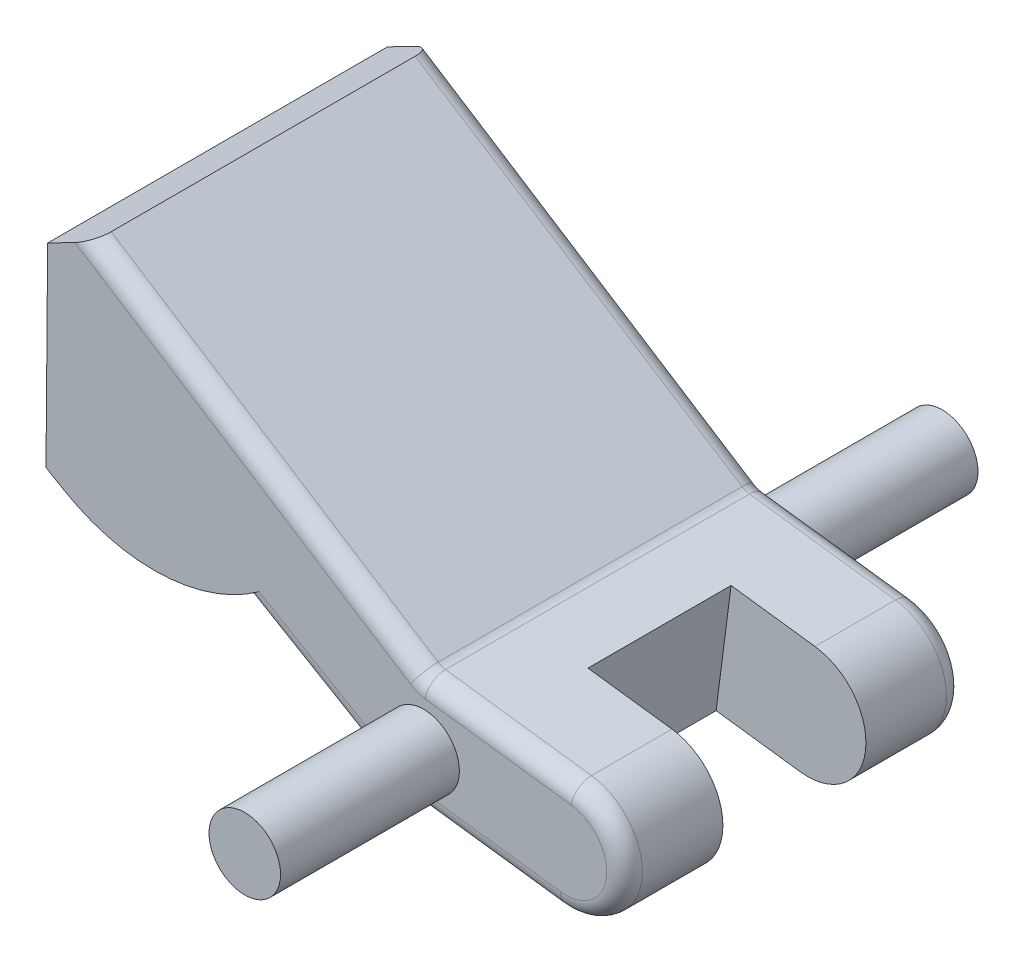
SolidWorks part; units mm, degrees
ref_plane "Front Plane" through (0, 0, 0) normal (0, 0, 1) x (1, 0, 0)
ref_plane "Top Plane" through (0, 0, 0) normal (0, 1, 0) x (1, 0, 0)
ref_plane "Right Plane" through (0, 0, 0) normal (1, 0, 0) x (0, 0, -1)
sketch "Sketch1" plane through (0, 0, 0) normal (0, 0, 1) x (1, 0, 0)
  line L0 (0, 3.5617) -> (-21, 17)
  line L2 (-1.5216, -2.5855) -> (-10.1399, 2.4865)
  line L4 (-10.1399, 2.4865) -> (-12.6759, -1.8227)
  line L5 (-12.6759, -1.8227) -> (-21.1154, 3.1441)
  line L6 (-21.1154, 3.1441) -> (-21, 17)
  line L7 (-0.3843, -2.9753) -> (7.5498, -4)
  line L8 (0, 3.5617) -> (8.3866, 2.4785)
  line L9 (-13.9572, -4) -> (8.3866, -4) construction
  arc A0 (-0.3843, -2.9753) -> (-1.5216, -2.5855) centre (0, 0) cw
  arc A1 (8.3866, 2.4785) -> (7.5498, -4) centre (7.9682, -0.7607) cw
  point P14 (0, 0)
  point P15 (0, 0)
  point P16 (8.544, 0)
  point P17 (7.5207, 2.7287)
  point P18 (7.5207, 2.7287)
  point P19 (-25.0337, 23.5654)
  point P20 (7.5514, -3.9971)
  point P21 (7.1547, -4.6702)
  point P22 (0, 0)
  point P23 (6.9769, -5)
  point P24 (22.5866, -5)
  dimension "D1" = 3
  dimension "D2" = 10
  dimension "D3" = 5
  dimension "D4" = 21
  dimension "D5" = 120
  dimension "D6" = 12
  dimension "D7" = 8
  dimension "D8" = 4
  dimension "D9" = 21
extrude "Boss-Extrude1" add sketch "Sketch1" along normal mid plane 19
sketch "Sketch2" plane through (0, 0, 0) normal (0, 0, 1) x (1, 0, 0)
  circle A0 centre (0, 0) radius 2
  dimension "D1" = 4
extrude "Boss-Extrude2" add sketch "Sketch2" along normal mid plane 39
sketch "Sketch6" plane through (0, 0, 0) normal (0, 0, 1) x (1, 0, 0)
  line L0 (0, 0) -> (-17.4384, 4.4611) construction
  line L1 (-21.1154, 3.1441) -> (-12.6759, -1.8227) construction
  circle A0 centre (-17.4384, 4.4611) radius 1
  dimension "D2" = 2
  dimension "D1" = 18
  dimension "D3" = 3
extrude "Boss-Extrude3" [suppressed] add sketch "Sketch6" along normal mid plane 30 separate body
sketch "Sketch7" plane through (-8.6183, 5.072, 0) normal (0.8618, -0.5072, 0) x (0, 0, -1)
  line L0 (-9.5, -8) -> (9.5, -8) construction
  line L1 (-5, -8) -> (5, -8)
  line L2 (-5, -8) -> (-5, -3)
  line L3 (-5, -3) -> (5, -3)
  line L4 (5, -8) -> (5, -3)
  line L5 (-9.5, -3) -> (9.5, -3) construction
  line L6 (0, -8) -> (0, -3) construction
  dimension "D1" = 10
extrude "Cut-Extrude3" cut sketch "Sketch7" against normal through all
sketch "Sketch5" plane through (-1.5216, -2.5855, 0) normal (-0.5072, -0.8618, 0) x (0.8618, -0.5072, 0)
  line L0 (-22.6793, 0) -> (0, 0) construction
  line L1 (-22.6793, -5) -> (-22.6793, 5) construction
  circle A0 centre (-16.27, 0) radius 2.413
  circle A1 centre (-16.27, 0) radius 3.302
  dimension "D1" = 6.604
  dimension "D2" = 4.826
  dimension "D3" = 16.27
extrude "Cut-Extrude2" cut sketch "Sketch5" against normal blind 3.5
sketch "Sketch8" plane through (-1.5216, -2.5855, 0) normal (-0.5072, -0.8618, 0) x (0.8618, -0.5072, 0)
  line L1 (-19.7926, -5) -> (-10, -5)
  line L2 (-19.7926, -5) -> (-19.7926, 5)
  line L3 (-19.7926, 5) -> (-10, 5)
  line L4 (-10, -5) -> (-10, 5)
extrude "Cut-Extrude4" [suppressed] cut sketch "Sketch8" along normal up to surface (5 mm away)
fillet "Fillet3" radius 10 2 edges at (-12.6759, -1.8227, -7.25) (-12.6759, -1.8227, 7.25)
fillet "Fillet1" radius 1 2 edges at (-12.6978, 3.9918, 0) (-13.464, 4.4427, 0)
fillet "Fillet2" radius 1 13 edges at (-5.8307, -0.0495, 9.5) (-5.8307, -0.0495, -9.5) (-0.9727, -2.8379, 9.5) (-0.9727, -2.8379, -9.5) (3.5828, -3.4876, 9.5) (3.5828, -3.4876, -9.5) (11.2075, -1.1791, 9.5) (11.2075, -1.1791, -9.5) (4.1933, 3.0201, 9.5) (4.1933, 3.0201, -9.5) (0, 3.5617, 0) (-10.5, 10.2808, 9.5) (-10.5, 10.2808, -9.5)
sketch "Sketch9" plane through (0.4525, 3.5032, 0) normal (0.1281, 0.9918, 0) x (0.9918, -0.1281, 0)
  line L0 (3.2662, 0) -> (11.2662, 0) construction
  line L1 (3.2662, -4) -> (11.2662, -4)
  line L2 (3.2662, -4) -> (3.2662, 4)
  line L3 (3.2662, 4) -> (11.2662, 4)
  line L4 (11.2662, -4) -> (11.2662, 4)
  line L5 (11.2662, -8.5) -> (11.2662, 8.5) construction
  dimension "D1" = 8
  dimension "D2" = 8
extrude "Cut-Extrude5" cut sketch "Sketch9" against normal up to surface (6.5323 mm away)
chamfer "Chamfer1" distance 3 angle 60 5 edges at (-21.0626, 9.4816, 9.5) (-21.0626, 9.4816, -9.5) (-21.0029, 16.6541, 9.2071) (-21.0029, 16.6541, -9.2071) (-21, 17, 0)
